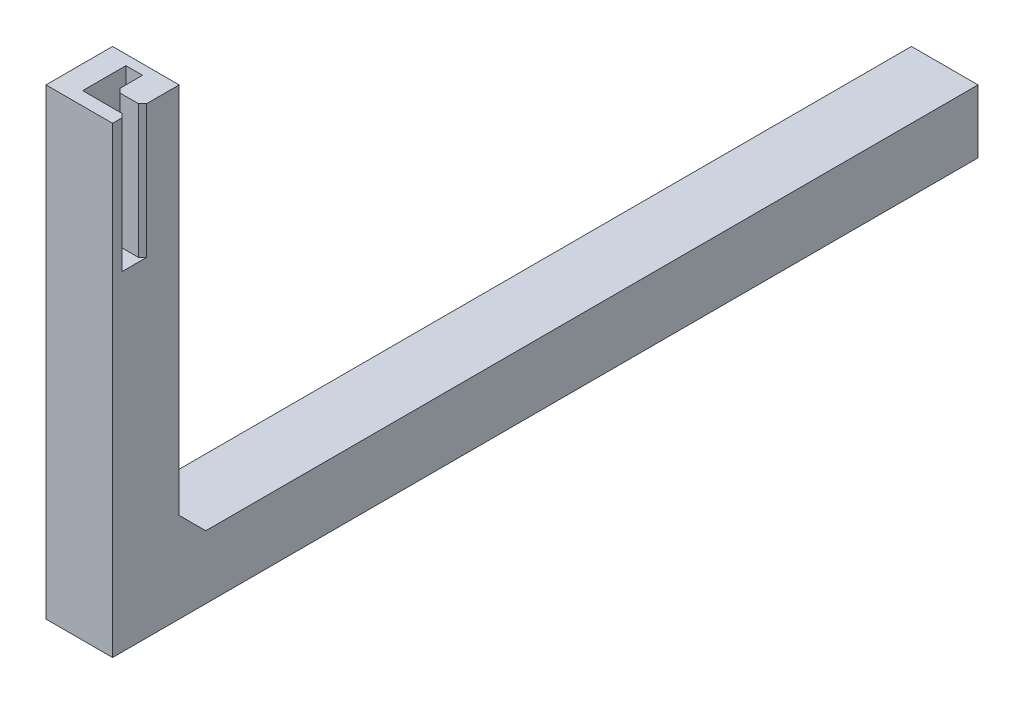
SolidWorks part; units mm, degrees
ref_plane "Plan de face" through (0, 0, 0) normal (0, 0, 1) x (1, 0, 0)
ref_plane "Plan de dessus" through (0, 0, 0) normal (0, 1, 0) x (1, 0, 0)
ref_plane "Plan de droite" through (0, 0, 0) normal (1, 0, 0) x (0, 0, -1)
sketch "Esquisse1" plane through (0, 0, 0) normal (1, 0, 0) x (0, 0, -1)
  line L0 (0, 0) -> (0, 70)
  line L1 (0, 70) -> (10, 70)
  line L2 (10, 70) -> (10, 10)
  line L3 (10, 10) -> (130, 10)
  line L4 (130, 10) -> (130, 0)
  line L5 (130, 0) -> (0, 0)
  dimension "D1" = 10
  dimension "D2" = 130
  dimension "D3" = 70
extrude "Boss.-Extru.1" add sketch "Esquisse1" against normal blind 10
chamfer "Chanfrein1" distance 4 angle 45 1 edges at (-5, 10, -10)
chamfer "Chanfrein3" distance 0.5 angle 45 4 edges at (-5, 0, -130) (-10, 0, -65) (-5, 0, 0) (0, 0, -65)
sketch "Esquisse2" plane through (0, 70, 0) normal (0, 1, 0) x (1, 0, 0)
  line L8 (0, 2) -> (-6.5, 2)
  line L9 (0, 10) -> (0, 0) construction
  line L10 (-6.5, 2) -> (-6.5, 8.5)
  line L11 (-6.5, 8.5) -> (-4, 8.5)
  line L12 (-4, 8.5) -> (-4, 4.5)
  line L13 (-4, 4.5) -> (0, 4.5)
  line L14 (0, 4.5) -> (0, 2)
  line L15 (-10, 0) -> (0, 0) construction
  dimension "D1" = 2.5
  dimension "D2" = 2
  dimension "D3" = 4
extrude "Enlèv. mat.-Extru.1" cut sketch "Esquisse2" against normal blind 20
chamfer "Chanfrein4" distance 0.6 angle 45 3 edges at (-4, 60, -4.5) (0, 60, -2) (0, 60, -4.5)
